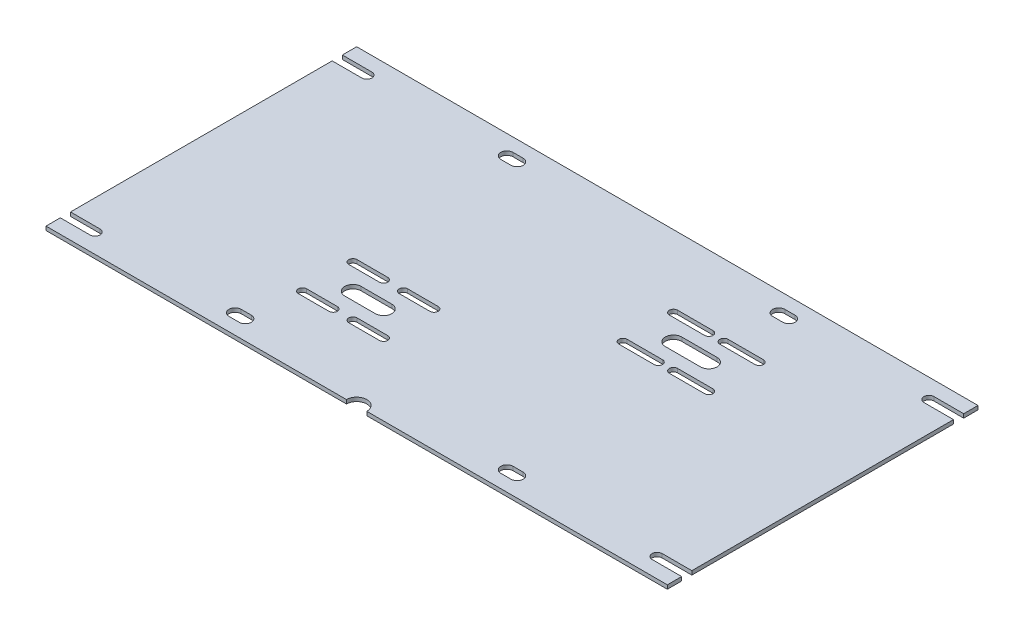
SolidWorks part; units mm, degrees
ref_plane "Alzado" through (0, 0, 0) normal (0, 0, 1) x (1, 0, 0)
ref_plane "Planta" through (0, 0, 0) normal (0, 1, 0) x (1, 0, 0)
ref_plane "Vista lateral" through (0, 0, 0) normal (1, 0, 0) x (0, 0, -1)
sketch "Croquis1" plane through (0, 0, 0) normal (0, 1, 0) x (1, 0, 0)
  line L1 (-152.4, 76.2) -> (152.4, 76.2)
  line L2 (-152.4, 76.2) -> (-152.4, -76.2)
  line L3 (-152.4, -76.2) -> (152.4, -76.2)
  line L4 (152.4, 76.2) -> (152.4, -76.2)
  line L5 (-152.4, 76.2) -> (152.4, -76.2) construction
  line L6 (-152.4, -76.2) -> (152.4, 76.2) construction
  point P0 (0, 0)
  dimension "D1" = 152.4
  dimension "D2" = 304.8
extrude "Saliente-Extruir1" add sketch "Croquis1" along normal blind 1.9
sketch "Sketch1" plane through (0, 1.9, 0) normal (0, 1, 0) x (1, 0, 0)
  line L0 (152.4, 76.2) -> (-152.4, 76.2) construction
  line L1 (-133.35, 57.15) -> (-152.4, 57.15) construction
  line L2 (-133.35, 57.15) -> (-133.35, 76.2) construction
  line L3 (-133.35, 76.2) -> (-152.4, 76.2) construction
  line L4 (-152.4, 57.15) -> (-152.4, 76.2) construction
  line L5 (-133.35, 57.15) -> (-152.4, 76.2) construction
  line L6 (-133.35, 76.2) -> (-152.4, 57.15) construction
  line L7 (-152.4, 76.2) -> (-152.4, -76.2) construction
  line L8 (-147.875, 66.675) -> (-137.875, 66.675) construction
  line L11 (-152.4, 69.175) -> (-137.875, 69.175)
  line L12 (-147.875, 64.175) -> (-137.875, 64.175)
  line L13 (0, -76.2) -> (0, 76.2) construction
  line L14 (0, 0) -> (-152.4, 0) construction
  line L15 (-69.175, 66.675) -> (-64.175, 66.675) construction
  line L16 (-69.175, 69.675) -> (-64.175, 69.675)
  line L17 (-69.175, 63.675) -> (-64.175, 63.675)
  line L19 (-152.4, 69.175) -> (-152.4, 64.175)
  line L21 (-152.4, 64.175) -> (-147.875, 64.175)
  line L22 (69.175, 66.675) -> (64.175, 66.675) construction
  line L23 (69.175, 69.675) -> (64.175, 69.675)
  line L24 (69.175, 63.675) -> (64.175, 63.675)
  line L25 (147.875, 66.675) -> (137.875, 66.675) construction
  line L32 (152.4, 64.175) -> (147.875, 64.175)
  line L33 (152.4, 69.175) -> (152.4, 64.175)
  line L34 (147.875, 64.175) -> (137.875, 64.175)
  line L35 (152.4, 69.175) -> (137.875, 69.175)
  line L36 (-69.175, -66.675) -> (-64.175, -66.675) construction
  line L37 (-69.175, -69.675) -> (-64.175, -69.675)
  line L38 (-69.175, -63.675) -> (-64.175, -63.675)
  line L39 (69.175, -66.675) -> (64.175, -66.675) construction
  line L40 (69.175, -69.675) -> (64.175, -69.675)
  line L41 (69.175, -63.675) -> (64.175, -63.675)
  line L48 (147.875, -66.675) -> (137.875, -66.675) construction
  line L49 (-147.875, -66.675) -> (-137.875, -66.675) construction
  line L52 (-152.4, -57.15) -> (-152.4, -76.2) construction
  line L56 (152.4, -69.175) -> (137.875, -69.175)
  line L57 (147.875, -64.175) -> (137.875, -64.175)
  line L58 (152.4, -69.175) -> (152.4, -64.175)
  line L59 (152.4, -64.175) -> (147.875, -64.175)
  line L60 (-152.4, -64.175) -> (-147.875, -64.175)
  line L61 (-152.4, -69.175) -> (-152.4, -64.175)
  line L62 (-147.875, -64.175) -> (-137.875, -64.175)
  line L63 (-152.4, -69.175) -> (-137.875, -69.175)
  arc A4 (-137.875, 64.175) -> (-137.875, 69.175) centre (-137.875, 66.675) ccw
  arc A5 (-69.175, 69.675) -> (-69.175, 63.675) centre (-69.175, 66.675) ccw
  arc A6 (-64.175, 63.675) -> (-64.175, 69.675) centre (-64.175, 66.675) ccw
  arc A7 (69.175, 69.675) -> (69.175, 63.675) centre (69.175, 66.675) cw
  arc A8 (64.175, 63.675) -> (64.175, 69.675) centre (64.175, 66.675) cw
  arc A9 (137.875, 64.175) -> (137.875, 69.175) centre (137.875, 66.675) cw
  arc A10 (-69.175, -69.675) -> (-69.175, -63.675) centre (-69.175, -66.675) cw
  arc A11 (-64.175, -63.675) -> (-64.175, -69.675) centre (-64.175, -66.675) cw
  arc A12 (69.175, -69.675) -> (69.175, -63.675) centre (69.175, -66.675) ccw
  arc A13 (64.175, -63.675) -> (64.175, -69.675) centre (64.175, -66.675) ccw
  arc A14 (137.875, -64.175) -> (137.875, -69.175) centre (137.875, -66.675) ccw
  arc A15 (-137.875, -64.175) -> (-137.875, -69.175) centre (-137.875, -66.675) cw
  point P0 (-142.875, 66.675)
  point P11 (-142.875, 66.675)
  point P22 (-66.675, 66.675)
  point P27 (-142.875, 66.675)
  point P32 (66.675, 66.675)
  point P48 (142.875, 66.675)
  point P51 (-66.675, -66.675)
  point P58 (66.675, -66.675)
  point P86 (142.875, -66.675)
  point P87 (-142.875, -66.675)
  dimension "D2" = 3
  dimension "D1" = 19.05
  dimension "D3" = 10
  dimension "D4" = 76.2
  dimension "D5" = 5
  dimension "D6" = 5
extrude "Cut-Extrude1" cut sketch "Sketch1" against normal through all
sketch "Croquis5" plane through (0, 1.9, 0) normal (0, 1, 0) x (1, 0, 0)
  line L0 (51.8085, -16.2006) -> (39.4342, -28.575) construction
  line L1 (39.4342, -28.575) -> (173.4, -37.15) construction
  line L2 (152.4, -64.175) -> (152.4, 64.175) construction
  line L3 (-152.4, -76.2) -> (152.4, -76.2) construction
  line L4 (0, 76.2) -> (0, -76.2) construction
  line L5 (16.9342, -6.075) -> (61.9342, -6.075) construction
  line L6 (16.9342, -6.075) -> (16.9342, -51.075) construction
  line L7 (16.9342, -51.075) -> (61.9342, -51.075) construction
  line L8 (61.9342, -6.075) -> (61.9342, -51.075) construction
  line L9 (16.9342, -6.075) -> (61.9342, -51.075) construction
  line L10 (16.9342, -51.075) -> (61.9342, -6.075) construction
  line L11 (152.4, 76.2) -> (-152.4, 76.2) construction
  line L12 (-152.4, 0) -> (152.4, 0) construction
  line L13 (-152.4, 64.175) -> (-152.4, -64.175) construction
  line L14 (-152.4, 57.15) -> (152.4, 57.15) construction
  line L15 (-152.4, -57.15) -> (152.4, -57.15) construction
  line L16 (33.8504, 51.075) -> (78.8504, 51.075) construction
  line L17 (33.8504, 51.075) -> (33.8504, 6.075) construction
  line L18 (33.8504, 6.075) -> (78.8504, 6.075) construction
  line L19 (78.8504, 51.075) -> (78.8504, 6.075) construction
  line L20 (78.8504, 6.075) -> (33.8504, 51.075) construction
  line L21 (33.8504, 6.075) -> (78.8504, 51.075) construction
  line L22 (68.7248, 40.9494) -> (56.3504, 28.575) construction
  line L23 (56.3504, 28.575) -> (173.4, -37.15) construction
  line L24 (50.6482, 28.575) -> (67.9685, 28.575) construction
  line L25 (34.4243, -28.575) -> (49.4563, -28.575) construction
  line L26 (39.4342, 0) -> (39.4342, -57.15) construction
  line L27 (-61.9342, -6.075) -> (-61.9342, -51.075) construction
  line L28 (-16.9342, -51.075) -> (-61.9342, -51.075) construction
  line L29 (-16.9342, -6.075) -> (-16.9342, -51.075) construction
  line L30 (-16.9342, -6.075) -> (-61.9342, -6.075) construction
  line L31 (-78.8504, 51.075) -> (-78.8504, 6.075) construction
  line L32 (-33.8504, 51.075) -> (-33.8504, 6.075) construction
  line L33 (-33.8504, 51.075) -> (-78.8504, 51.075) construction
  line L34 (56.3504, 57.15) -> (56.3504, 0) construction
  circle A0 centre (173.4, -37.15) radius 5
  circle A1 centre (39.4342, -28.575) radius 17.5 construction
  circle A2 centre (51.8085, -16.2006) radius 2.05
  circle A3 centre (51.8085, -40.9494) radius 2.05
  circle A4 centre (39.4342, -28.575) radius 17.5 construction
  circle A5 centre (27.0598, -40.9494) radius 2.05
  circle A6 centre (39.4342, -28.575) radius 17.5 construction
  circle A7 centre (27.0598, -16.2006) radius 2.05
  circle A8 centre (39.4342, -28.575) radius 17.5 construction
  circle A10 centre (56.3504, 28.575) radius 17.5 construction
  circle A14 centre (68.7248, 40.9494) radius 2.05
  circle A15 centre (68.7248, 16.2006) radius 2.05
  circle A16 centre (43.9761, 16.2006) radius 2.05
  circle A17 centre (43.9761, 40.9494) radius 2.05
  circle A18 centre (-27.0598, -40.9494) radius 2.05
  circle A19 centre (-51.8085, -40.9494) radius 2.05
  circle A20 centre (-51.8085, -16.2006) radius 2.05
  circle A21 centre (-27.0598, -16.2006) radius 2.05
  circle A22 centre (-173.4, -37.15) radius 5
  circle A23 centre (-43.9761, 16.2006) radius 2.05
  circle A24 centre (-68.7248, 16.2006) radius 2.05
  circle A25 centre (-68.7248, 40.9494) radius 2.05
  circle A26 centre (-43.9761, 40.9494) radius 2.05
sketch "Croquis6" plane through (0, 1.9, 0) normal (0, 1, 0) x (1, 0, 0)
  line L0 (56.3504, 28.575) -> (67.9685, 28.575) construction
  line L1 (33.8504, 6.075) -> (78.8504, 51.075) construction
  line L2 (56.3504, 28.575) -> (50.6482, 28.575) construction
  line L3 (39.4342, -28.575) -> (49.4563, -28.575) construction
  line L4 (39.4342, -28.575) -> (34.4243, -28.575) construction
  line L5 (68.7248, 40.9494) -> (80.3429, 40.9494) construction
  line L6 (80.3429, 40.9494) -> (63.0226, 40.9494) construction
  line L7 (80.3429, 38.8994) -> (63.0226, 38.8994)
  line L10 (67.9685, 28.575) -> (50.6482, 28.575) construction
  line L11 (67.9685, 24.525) -> (50.6482, 24.525)
  line L12 (67.9685, 32.625) -> (50.6482, 32.625)
  line L13 (80.3429, 42.9994) -> (63.0226, 42.9994)
  line L14 (55.5941, 40.9494) -> (38.2738, 40.9494) construction
  line L15 (55.5941, 38.8994) -> (38.2738, 38.8994)
  line L16 (55.5941, 42.9994) -> (38.2738, 42.9994)
  line L17 (80.3429, 16.2006) -> (63.0226, 16.2006) construction
  line L18 (80.3429, 14.1506) -> (63.0226, 14.1506)
  line L19 (80.3429, 18.2506) -> (63.0226, 18.2506)
  line L20 (55.5941, 16.2006) -> (38.2738, 16.2006) construction
  line L21 (55.5941, 14.1506) -> (38.2738, 14.1506)
  line L22 (55.5941, 18.2506) -> (38.2738, 18.2506)
  line L23 (46.7987, -16.2006) -> (61.8306, -16.2006) construction
  line L24 (46.7987, -14.1506) -> (61.8306, -14.1506) construction
  line L25 (46.7987, -18.2506) -> (61.8306, -18.2506) construction
  line L26 (22.0499, -16.2006) -> (37.0819, -16.2006) construction
  line L27 (22.0499, -14.1506) -> (37.0819, -14.1506) construction
  line L28 (22.0499, -18.2506) -> (37.0819, -18.2506) construction
  line L29 (34.4243, -28.575) -> (49.4563, -28.575) construction
  line L30 (34.4243, -24.525) -> (49.4563, -24.525) construction
  line L31 (34.4243, -32.625) -> (49.4563, -32.625) construction
  line L32 (22.0499, -40.9494) -> (37.0819, -40.9494) construction
  line L33 (22.0499, -42.9994) -> (37.0819, -42.9994) construction
  line L34 (22.0499, -38.8994) -> (37.0819, -38.8994) construction
  line L35 (46.7987, -40.9494) -> (61.8306, -40.9494) construction
  line L36 (46.7987, -42.9994) -> (61.8306, -42.9994) construction
  line L37 (46.7987, -38.8994) -> (61.8306, -38.8994) construction
  line L38 (0, -76.2) -> (0, 76.2) construction
  line L39 (152.4, 76.2) -> (-152.4, 76.2) construction
  line L40 (-46.7987, -16.2006) -> (-61.8306, -16.2006) construction
  line L41 (-46.7987, -14.1506) -> (-61.8306, -14.1506)
  line L42 (-46.7987, -18.2506) -> (-61.8306, -18.2506)
  line L43 (-22.0499, -16.2006) -> (-37.0819, -16.2006) construction
  line L44 (-22.0499, -14.1506) -> (-37.0819, -14.1506)
  line L45 (-22.0499, -18.2506) -> (-37.0819, -18.2506)
  line L46 (-34.4243, -28.575) -> (-49.4563, -28.575) construction
  line L47 (-34.4243, -24.525) -> (-49.4563, -24.525)
  line L48 (-34.4243, -32.625) -> (-49.4563, -32.625)
  line L49 (-22.0499, -40.9494) -> (-37.0819, -40.9494) construction
  line L50 (-22.0499, -42.9994) -> (-37.0819, -42.9994)
  line L51 (-22.0499, -38.8994) -> (-37.0819, -38.8994)
  line L52 (-46.7987, -40.9494) -> (-61.8306, -40.9494) construction
  line L53 (-46.7987, -42.9994) -> (-61.8306, -42.9994)
  line L54 (-46.7987, -38.8994) -> (-61.8306, -38.8994)
  line L55 (-39.4342, -28.575) -> (-34.4243, -28.575) construction
  line L56 (-39.4342, -28.575) -> (-49.4563, -28.575) construction
  arc A2 (67.9685, 24.525) -> (67.9685, 32.625) centre (67.9685, 28.575) ccw
  arc A3 (50.6482, 32.625) -> (50.6482, 24.525) centre (50.6482, 28.575) ccw
  arc A4 (80.3429, 38.8994) -> (80.3429, 42.9994) centre (80.3429, 40.9494) ccw
  arc A5 (63.0226, 42.9994) -> (63.0226, 38.8994) centre (63.0226, 40.9494) ccw
  arc A6 (55.5941, 38.8994) -> (55.5941, 42.9994) centre (55.5941, 40.9494) ccw
  arc A7 (38.2738, 42.9994) -> (38.2738, 38.8994) centre (38.2738, 40.9494) ccw
  arc A8 (80.3429, 14.1506) -> (80.3429, 18.2506) centre (80.3429, 16.2006) ccw
  arc A9 (63.0226, 18.2506) -> (63.0226, 14.1506) centre (63.0226, 16.2006) ccw
  arc A10 (55.5941, 14.1506) -> (55.5941, 18.2506) centre (55.5941, 16.2006) ccw
  arc A11 (38.2738, 18.2506) -> (38.2738, 14.1506) centre (38.2738, 16.2006) ccw
  arc A12 (46.7987, -14.1506) -> (46.7987, -18.2506) centre (46.7987, -16.2006) ccw construction
  arc A13 (61.8306, -18.2506) -> (61.8306, -14.1506) centre (61.8306, -16.2006) ccw construction
  arc A14 (22.0499, -14.1506) -> (22.0499, -18.2506) centre (22.0499, -16.2006) ccw construction
  arc A15 (37.0819, -18.2506) -> (37.0819, -14.1506) centre (37.0819, -16.2006) ccw construction
  arc A16 (34.4243, -24.525) -> (34.4243, -32.625) centre (34.4243, -28.575) ccw construction
  arc A17 (49.4563, -32.625) -> (49.4563, -24.525) centre (49.4563, -28.575) ccw construction
  arc A18 (22.0499, -42.9994) -> (22.0499, -38.8994) centre (22.0499, -40.9494) cw construction
  arc A19 (37.0819, -38.8994) -> (37.0819, -42.9994) centre (37.0819, -40.9494) cw construction
  arc A20 (46.7987, -42.9994) -> (46.7987, -38.8994) centre (46.7987, -40.9494) cw construction
  arc A21 (61.8306, -38.8994) -> (61.8306, -42.9994) centre (61.8306, -40.9494) cw construction
  arc A22 (-46.7987, -14.1506) -> (-46.7987, -18.2506) centre (-46.7987, -16.2006) cw
  arc A23 (-61.8306, -18.2506) -> (-61.8306, -14.1506) centre (-61.8306, -16.2006) cw
  arc A24 (-22.0499, -14.1506) -> (-22.0499, -18.2506) centre (-22.0499, -16.2006) cw
  arc A25 (-37.0819, -18.2506) -> (-37.0819, -14.1506) centre (-37.0819, -16.2006) cw
  arc A26 (-34.4243, -24.525) -> (-34.4243, -32.625) centre (-34.4243, -28.575) cw
  arc A27 (-49.4563, -32.625) -> (-49.4563, -24.525) centre (-49.4563, -28.575) cw
  arc A28 (-22.0499, -42.9994) -> (-22.0499, -38.8994) centre (-22.0499, -40.9494) ccw
  arc A29 (-37.0819, -38.8994) -> (-37.0819, -42.9994) centre (-37.0819, -40.9494) ccw
  arc A30 (-46.7987, -42.9994) -> (-46.7987, -38.8994) centre (-46.7987, -40.9494) ccw
  arc A31 (-61.8306, -38.8994) -> (-61.8306, -42.9994) centre (-61.8306, -40.9494) ccw
  point P16 (71.6827, 40.9494)
  point P22 (59.3084, 28.575)
  point P29 (46.934, 40.9494)
  point P37 (71.6827, 16.2006)
  point P44 (46.934, 16.2006)
  point P49 (54.3147, -16.2006)
  point P60 (29.5659, -16.2006)
  point P65 (41.9403, -28.575)
  point P73 (29.5659, -40.9494)
  point P80 (54.3147, -40.9494)
  point P92 (-54.3147, -16.2006)
  point P99 (-29.5659, -16.2006)
  point P106 (-41.9403, -28.575)
  point P113 (-29.5659, -40.9494)
  point P120 (-54.3147, -40.9494)
extrude "Cortar-Extruir1" cut sketch "Croquis6" against normal through all
sketch "Croquis8" [suppressed] plane through (0, 1.9, 0) normal (0, 1, 0) x (1, 0, 0)
  line L0 (133.35, 76.2) -> (133.35, -76.2) construction
  line L1 (152.4, 76.2) -> (-152.4, 76.2) construction
  line L2 (36.5083, -28.575) -> (36.5083, -48.725) construction
  line L3 (16.5083, -53.575) -> (56.5083, -53.575) construction
  line L4 (16.5083, -53.575) -> (16.5083, -3.575) construction
  line L5 (16.5083, -3.575) -> (56.5083, -3.575) construction
  line L6 (56.5083, -53.575) -> (56.5083, -3.575) construction
  line L7 (16.5083, -53.575) -> (56.5083, -3.575) construction
  line L8 (16.5083, -3.575) -> (56.5083, -53.575) construction
  line L9 (-152.4, -76.2) -> (152.4, -76.2) construction
  line L10 (152.4, -64.175) -> (152.4, 64.175) construction
  line L11 (36.5083, -28.575) -> (173.4, -37.15) construction
  circle A0 centre (36.5083, -28.575) radius 20.15 construction
  circle A1 centre (56.5083, -3.575) radius 3 construction
  circle A2 centre (56.5083, -53.575) radius 3 construction
  circle A3 centre (16.5083, -53.575) radius 3 construction
  circle A4 centre (16.5083, -3.575) radius 3 construction
  point P6 (36.5083, -28.575)
  point P7 (36.5083, -28.575)
  point P12 (36.5083, -28.575)
  point P13 (36.5083, -28.575)
sketch "Croquis10" [suppressed] plane through (0, 1.9, 0) normal (0, 1, 0) x (1, 0, 0)
  line L0 (61.5553, -3.575) -> (53.5026, -3.575) construction
  line L1 (16.5083, -3.575) -> (56.5083, -3.575) construction
  line L2 (61.5553, -6.575) -> (53.5026, -6.575)
  line L3 (61.5553, -0.575) -> (53.5026, -0.575)
  line L4 (61.5553, -53.575) -> (53.5026, -53.575) construction
  line L5 (61.5553, -56.575) -> (53.5026, -56.575)
  line L6 (61.5553, -50.575) -> (53.5026, -50.575)
  line L7 (16.5083, -53.575) -> (56.5083, -53.575) construction
  line L8 (36.5083, -28.575) -> (41.5185, -28.575) construction
  line L9 (36.5083, -28.575) -> (33.5026, -28.575) construction
  line L10 (36.5083, -28.575) -> (36.5083, -48.725) construction
  line L11 (36.5083, -28.575) -> (36.5083, -48.725) construction
  line L12 (11.4613, -53.575) -> (19.5141, -53.575) construction
  line L13 (11.4613, -56.575) -> (19.5141, -56.575)
  line L14 (11.4613, -50.575) -> (19.5141, -50.575)
  line L15 (11.4613, -3.575) -> (19.5141, -3.575) construction
  line L16 (11.4613, -6.575) -> (19.5141, -6.575)
  line L17 (11.4613, -0.575) -> (19.5141, -0.575)
  line L18 (41.5185, -28.575) -> (33.5026, -28.575) construction
  line L19 (41.5185, -48.725) -> (33.5026, -48.725)
  line L20 (41.5185, -8.425) -> (33.5026, -8.425)
  arc A0 (61.5553, -6.575) -> (61.5553, -0.575) centre (61.5553, -3.575) ccw
  arc A1 (53.5026, -0.575) -> (53.5026, -6.575) centre (53.5026, -3.575) ccw
  arc A2 (61.5553, -56.575) -> (61.5553, -50.575) centre (61.5553, -53.575) ccw
  arc A3 (53.5026, -50.575) -> (53.5026, -56.575) centre (53.5026, -53.575) ccw
  circle A4 centre (56.5083, -3.575) radius 3 construction
  arc A5 (11.4613, -56.575) -> (11.4613, -50.575) centre (11.4613, -53.575) cw
  arc A6 (19.5141, -50.575) -> (19.5141, -56.575) centre (19.5141, -53.575) cw
  arc A7 (11.4613, -6.575) -> (11.4613, -0.575) centre (11.4613, -3.575) cw
  arc A8 (19.5141, -0.575) -> (19.5141, -6.575) centre (19.5141, -3.575) cw
  arc A9 (41.5185, -48.725) -> (41.5185, -8.425) centre (41.5185, -28.575) ccw
  arc A10 (33.5026, -8.425) -> (33.5026, -48.725) centre (33.5026, -28.575) ccw
  circle A11 centre (36.5083, -28.575) radius 20.15 construction
  point P4 (57.5289, -3.575)
  point P11 (57.5289, -53.575)
  point P29 (15.4877, -53.575)
  point P36 (15.4877, -3.575)
  point P41 (37.5105, -28.575)
extrude "Cortar-Extruir2" [suppressed] cut sketch "Croquis10" against normal through all
sketch "Croquis11" plane through (0, 1.9, 0) normal (0, 1, 0) x (1, 0, 0)
  line L0 (-152.4, -76.2) -> (152.4, -76.2) construction
  circle A0 centre (0, -76.2) radius 5
  dimension "D1" = 10
extrude "Cortar-Extruir3" cut sketch "Croquis11" against normal blind 10
equation "\"C_405\"=134.24"
equation "\"D8@Croquis5\"=\"C_405\""
equation "\"D12@Croquis5\"=\"C_405_apretado\""
equation "\"D13@Croquis5\"=\"C_405_flojo\""
equation "\"D14@Croquis5\"=\"C_405_apretado\""
equation "\"D17@Croquis5\"=\"C_405_flojo\""
equation "\"C_405_flojo\"= \"C_405\" - 10"
equation "\"C_405_apretado\"= \"C_405\" + 5"
equation "\"D8@Croquis6\"=\"D4@Croquis6\""
equation "\"D9@Croquis6\"=\"D2@Croquis6\""
equation "\"D10@Croquis6\"=\"D5@Croquis6\""
equation "\"D11@Croquis6\"=\"D10@Croquis6\""
equation "\"D12@Croquis6\"=\"D6@Croquis6\""
equation "\"D14@Croquis6\"=\"D3@Croquis6\""
equation "\"C_102\"= 137.16"
equation "\"C_102_flojo\"= \"C_102\" - 5"
equation "\"C_102_apretado\"= \"C_102\" + 3"
equation "\"D4@Croquis8\"=\"C_102\""
equation "\"D1@Croquis10\"=\"C_102_flojo\""
equation "\"D2@Croquis10\"=\"C_102_apretado\""
equation "\"D6@Croquis10\"=\"D4@Croquis10\""
